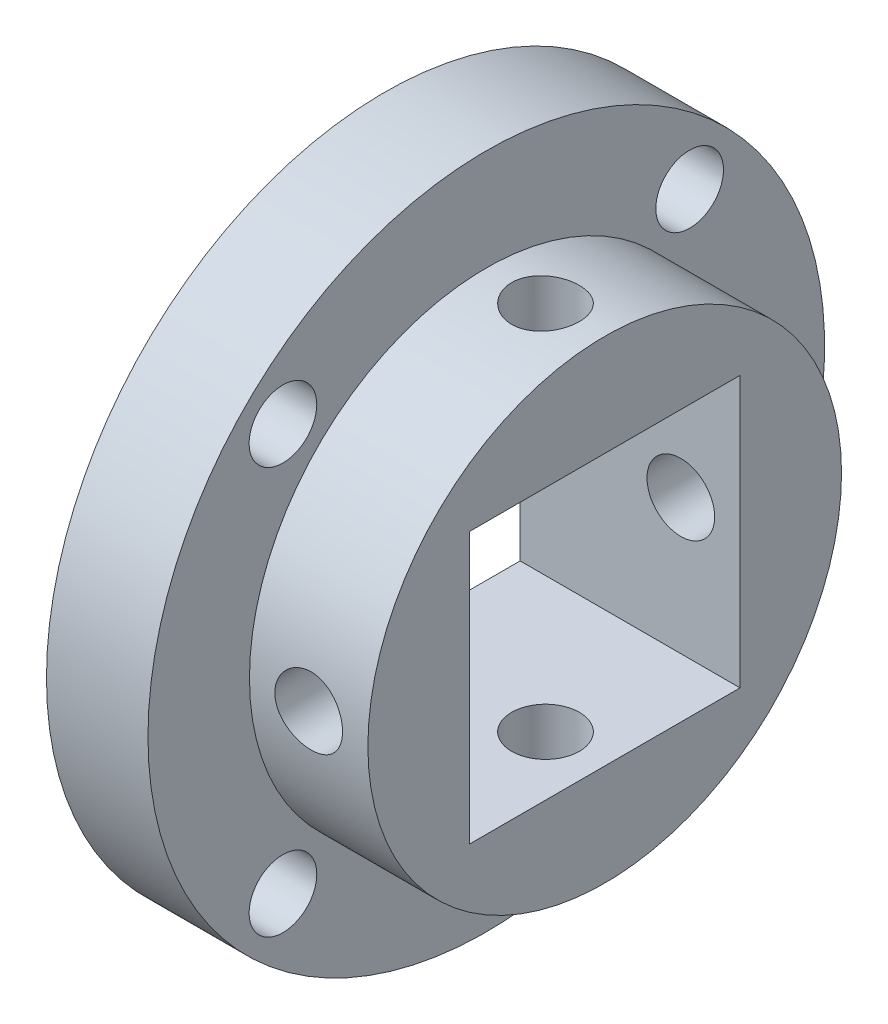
SolidWorks part; units mm, degrees
ref_plane "Plan de face" through (0, 0, 0) normal (0, 0, 1) x (1, 0, 0)
ref_plane "Plan de dessus" through (0, 0, 0) normal (0, 1, 0) x (1, 0, 0)
ref_plane "Plan de droite" through (0, 0, 0) normal (1, 0, 0) x (0, 0, -1)
sketch "Esquisse1" plane through (0, 0, 0) normal (0, 0, 1) x (1, 0, 0)
  line L0 (-19.0972, 0) -> (8.7608, 0) construction
  line L2 (0, 0) -> (13, 0)
  line L3 (0, 0) -> (0, 20)
  line L4 (0, 20) -> (6, 20)
  line L5 (13, 0) -> (13, 14)
  line L8 (13, 14) -> (6, 14)
  line L9 (6, 20) -> (6, 14)
  dimension "D1" = 6
  dimension "D2" = 7
  dimension "D3" = 20
  dimension "D4" = 6
revolve "Révolution1" add sketch "Esquisse1" angle 360 about L0
sketch "Esquisse2" plane through (13, 0, 0) normal (1, 0, 0) x (0, 0, -1)
  line L0 (-12.0208, 12.0208) -> (0, 0) construction
  line L1 (-8, 8) -> (8, 8)
  line L2 (-8, 8) -> (-8, -8)
  line L3 (-8, -8) -> (8, -8)
  line L4 (8, 8) -> (8, -8)
  line L5 (0, 0) -> (-30.1216, 0) construction
  circle A0 centre (-12.0208, 12.0208) radius 2
  circle A1 centre (12.0208, 12.0208) radius 2
  circle A2 centre (12.0208, -12.0208) radius 2
  circle A3 centre (-12.0208, -12.0208) radius 2
  dimension "D6" = 4
  dimension "D1" = 16
  dimension "D2" = 16
  dimension "D3" = 8
  dimension "D4" = 8
  dimension "D5" = 17
  dimension "D7" = 45
extrude "Enlèv. mat.-Extru.1" cut sketch "Esquisse2" against normal through all
sketch "Esquisse3" plane through (0, 0, 0) normal (0, 1, 0) x (1, 0, 0)
  line L0 (13, -14) -> (13, 14) construction
  circle A0 centre (9.5, 0) radius 2
  dimension "D2" = 4
  dimension "D1" = 3.5
extrude "Enlèv. mat.-Extru.2" cut sketch "Esquisse3" against normal through all
pattern_circular "Répétition circulaire1" count 4 over 360 about axis through (-19.0972, 0, 0) along (-1, 0, 0) of "Enlèv. mat.-Extru.2"
